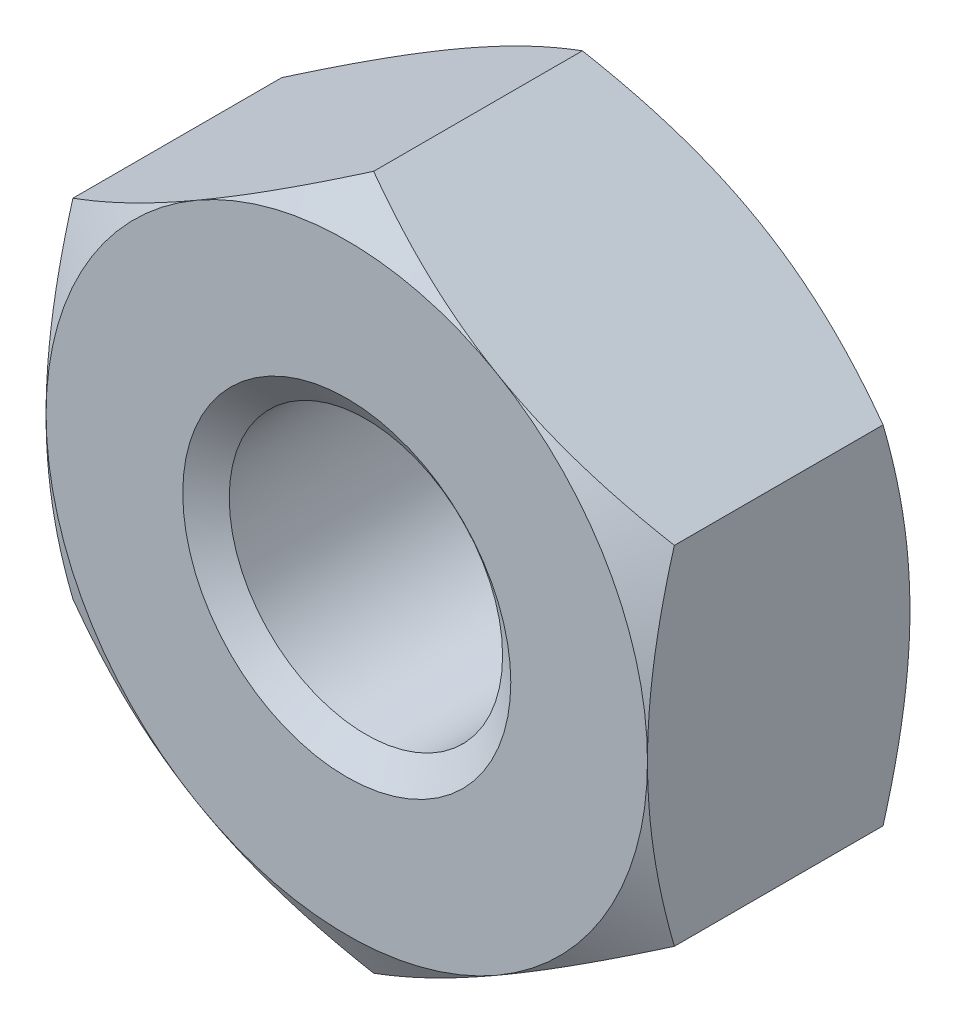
SolidWorks part; units mm, degrees
ref_plane "Plane1" through (0, 0, 0) normal (0, 0, 1) x (1, 0, 0)
ref_plane "Plane2" through (0, 0, 0) normal (0, 1, 0) x (1, 0, 0)
ref_plane "Plane3" through (0, 0, 0) normal (1, 0, 0) x (0, 0, -1)
revolve "EndChamfer" cut sketch "Sketch5"
sketch "Sketch5"
  line L0 (2.3746, 1.5) -> (2.182, 1.225)
  line L1 (2.4254, 1.5) -> (2.3746, 1.5)
  line L2 (2.4254, 1.5) -> (2.4254, 1.225)
  line L3 (2.4254, 1.225) -> (2.182, 1.225)
  line L6 (-0.0508, 1.5) -> (0, 1.5)
  line L7 (0, 1.5) -> (0.1926, 1.225)
  line L9 (0.1926, 1.225) -> (-0.0508, 1.225)
  line L10 (-0.0508, 1.225) -> (-0.0508, 1.5)
  line L11 (25.0375, 0) -> (38.388, 0) construction
  line L12 (2.4, 0) -> (0, 0) construction
extrude "BaseNut" add sketch "BaseNutSke" against normal blind 2.4
sketch "BaseNutSke" plane through (0, 0, 0) normal (0, 0, 1) x (1, 0, 0)
  line L6 (2.75, 1.5877) -> (2.75, -1.5877)
  line L7 (-2.75, 1.5877) -> (-2.75, -1.5877)
  line L8 (2.75, 1.5877) -> (0, 3.1754)
  line L9 (0, 3.1754) -> (-2.75, 1.5877)
  line L10 (-2.75, -1.5877) -> (0, -3.1754)
  line L11 (0, -3.1754) -> (2.75, -1.5877)
  circle A0 centre (0, 0) radius 1.25
  dimension "D4" = 2.75
  dimension "Tap_drill" = 2.5
  dimension "D1" = 120
  dimension "D2" = 2.75
  dimension "D3" = 2.75
  dimension "Width_flats" = 5.5
pattern_linear "ThdSchPat"
revolve "ThreadSchematic" cut sketch "ThdSchSke" angle 360 about L11
sketch "ThdSchSke" plane through (0, 0, 0) normal (0, 1, 0) x (1, 0, 0)
  line L0 (-1.5, 0.0254) -> (-1.25, 0.2005)
  line L1 (-1.25, 0.2005) -> (-0.625, 0.2005)
  line L2 (-0.625, 0.2005) -> (-0.625, -0.1497)
  line L3 (-0.625, -0.1497) -> (-1.25, -0.1497)
  line L4 (-1.25, -0.1497) -> (-1.5, 0.0254)
  line L5 (-3.175, 0.5) -> (3.175, 0.5) construction
  line L6 (0, 0.5) -> (0, -2.9874) construction
  line L7 (0, 2.1995) -> (0, 0.1751) construction
  dimension "D1" = 35
  dimension "VeeAngle" = 70
  dimension "SideAngle" = 55
  dimension "D2" = 0.0508
  dimension "OverCut" = 1.25
  dimension "Tap_Drill" = 2.5
  dimension "Advance" = 0.4698
  dimension "Thread_major" = 3
  dimension "Num_threads" = 6
  dimension "D4" = 50
  dimension "Offset1" = 2.4254
  dimension "ThreadMajor" = 1.5
  dimension "ChamferDepth" = 0.275
  dimension "Offset2" = 2.4762
sketch "Sketch4" plane through (0, 0, 0) normal (1, 0, 0) x (0, 0, -1)
  line L0 (2.4, 2.75) -> (2, 2.75)
  line L1 (2.4, 2.75) -> (2.4, 13.1754)
  line L2 (2, 13.1754) -> (2.4, 13.1754)
  line L3 (2, 13.1754) -> (2, 2.75)
  line L4 (0, 0) -> (34.925, 0) construction
  line L6 (2.4, 1.5877) -> (2.4, 3.1754) construction
  line L7 (0, 2.75) -> (-10, 2.75)
  line L8 (0, 1.5877) -> (0, 3.1754) construction
  line L9 (0.2456, 3.1754) -> (0.2456, 13.1754)
  line L10 (0.2456, 13.1754) -> (-10, 13.1754)
  line L11 (-10, 13.1754) -> (-10, 2.75)
  line L12 (0, 2.75) -> (0.2456, 3.1754)
  line L14 (0, 1.5877) -> (0, -1.5877) construction
  line L15 (2.4, 3.1754) -> (0, 3.1754) construction
  dimension "D1" = 2.75
  dimension "D2" = 30
  dimension "Bearing_ht" = 0.4
  dimension "D3" = 10
  dimension "D4" = 10
revolve "Bearing-Face" cut sketch "Sketch4" angle 360 about L4
sketch "Sketch3" plane through (0, 0, 0) normal (1, 0, 0) x (0, 0, -1)
  line L0 (2.4, 2.75) -> (2.1544, 3.1754)
  line L1 (2.1544, 3.1754) -> (2.1544, 13.1754)
  line L2 (2.1544, 13.1754) -> (12.4, 13.1754)
  line L3 (12.4, 13.1754) -> (12.4, 2.75)
  line L4 (12.4, 2.75) -> (2.4, 2.75)
  line L5 (2.4, 1.5877) -> (2.4, 3.1754) construction
  line L6 (2.4, 3.1754) -> (0, 3.1754) construction
  line L7 (0, 0) -> (38.6776, 0) construction
  line L8 (2.4, 0) -> (0, 0) construction
  line L9 (1.2, 3.1754) -> (1.2, 44.222) construction
  line L10 (0.2456, 13.1754) -> (-10, 13.1754)
  line L11 (-10, 13.1754) -> (-10, 2.75)
  line L12 (-10, 2.75) -> (0, 2.75)
  line L13 (0, 2.75) -> (0.2456, 3.1754)
  line L14 (0.2456, 3.1754) -> (0.2456, 13.1754)
  line L16 (2.4, 3.1754) -> (0, 3.1754) construction
  dimension "D1" = 2.75
  dimension "D2" = 30
  dimension "D3" = 10
  dimension "D4" = 10
revolve "Double-Chamfer" cut sketch "Sketch3" angle 360 about L7
equation "\"D2@BaseNutSke\" = \"Width_flats@BaseNutSke\" / 2"
equation "\"D3@BaseNutSke\" = \"Width_flats@BaseNutSke\" / 2"
equation "\"D1@Sketch3\" = \"Width_flats@BaseNutSke\" /2"
equation "\"D1@Sketch4\" = \"D2@BaseNutSke\""
equation "\"D4@BaseNutSke\" = \"D3@BaseNutSke\""
equation "\"Thread_major@ThdSchSke\" = \"Thread_major@ThreadCosmetic\""
equation "\"Tap_drill@ThdSchSke\" = \"Tap_drill@BaseNutSke\""
equation "\"Overcut@ThdSchSke\" = \"Tap_drill@ThdSchSke\" * 0.5"
equation "\"Num_threads@ThdSchPat\" = int(  ( \"Thickness@BaseNut\" - 0.0508 ) / \"Advance@ThdSchSke\" + 0.999 )  + 1"
equation "\"Advance@ThdSchPat\" = ( \"Thickness@BaseNut\" - 0.0508 ) /  (\"Num_threads@ThdSchPat\" - 1) 'relax it"
equation "' \"Num_threads@ThdSchPat\" = \"Num_threads@ThdSchPat\" - sgn( \"Num_threads@ThdSchPat\" - 1) '---chamfered tips only---"
equation "\"ThreadMajor@Sketch5\" = \"Thread_major@ThreadCosmetic\" * 0.5"
equation "\"ChamferDepth@Sketch5\" = (\"Thread_major@ThreadCosmetic\" - \"Tap_drill@BaseNutSke\") * 0.55"
equation "\"Offset1@Sketch5\" = \"Thickness@BaseNut\" + 0.0254"
equation "\"Offset2@Sketch5\" = \"Offset1@Sketch5\" + 0.0508"
